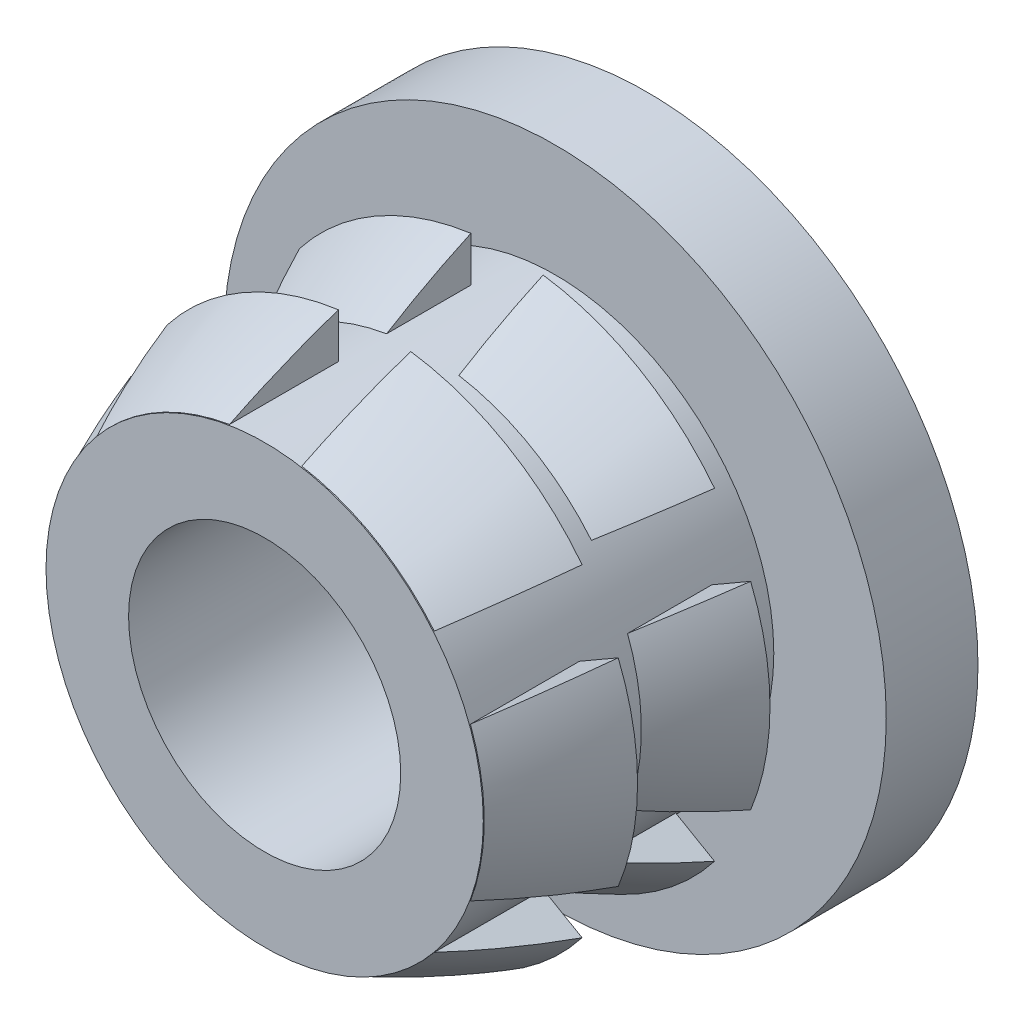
SolidWorks part; units mm, degrees
other "<flanged insert 4-40  S2>-<Move Face4>"
ref_plane "Front Plane" through (0, 0, 0) normal (0, 0, 1) x (1, 0, 0)
ref_plane "Top Plane" through (0, 0, 0) normal (0, 1, 0) x (1, 0, 0)
ref_plane "Right Plane" through (0, 0, 0) normal (1, 0, 0) x (0, 0, -1)
inserted part "flanged insert 4-40  S2"
